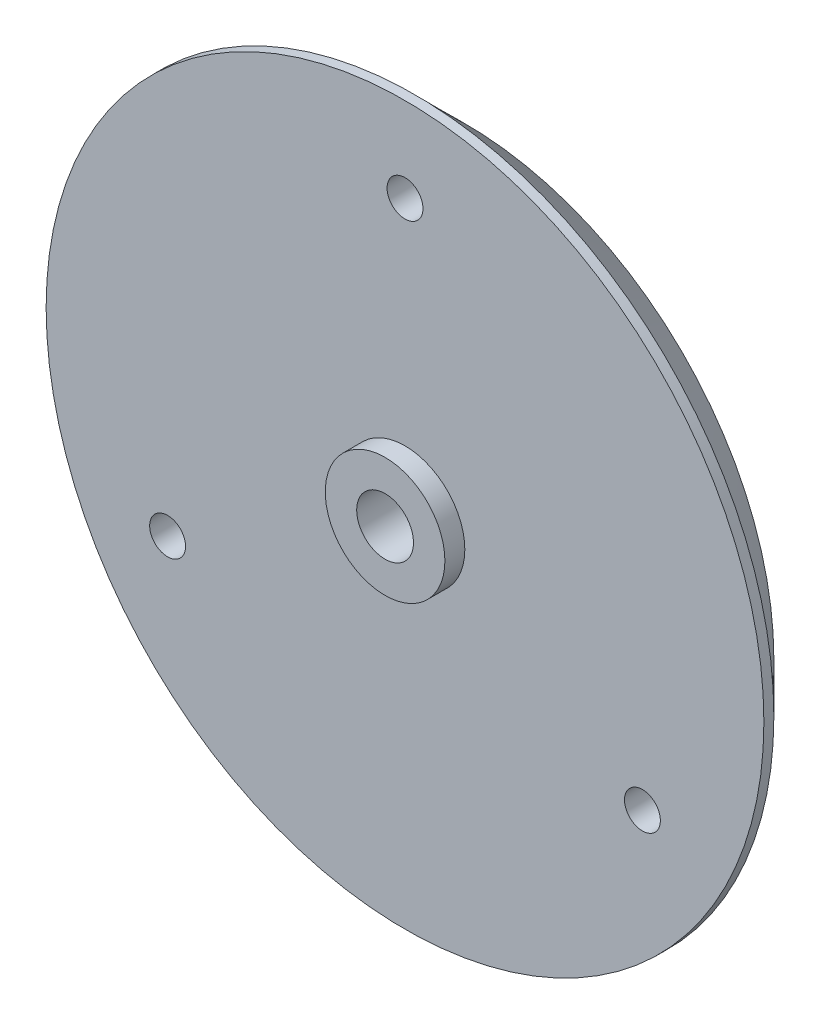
SolidWorks part; units mm, degrees
ref_plane "Plan de face" through (0, 0, 0) normal (0, 0, 1) x (1, 0, 0)
ref_plane "Plan de dessus" through (0, 0, 0) normal (0, 1, 0) x (1, 0, 0)
ref_plane "Plan de droite" through (0, 0, 0) normal (1, 0, 0) x (0, 0, -1)
sketch "Esquisse1" plane through (0, 0, 0) normal (0, 0, 1) x (1, 0, 0)
  circle A1 centre (0, 0) radius 18
extrude "Extrusion1" add sketch "Esquisse1" along normal blind 3
chamfer "Chanfrein1" distance 2.5 angle 45 1 edges at (18, 0, 0)
sketch "Esquisse2" plane through (0, 0, 0) normal (0, 0, -1) x (-1, 0, 0)
  circle A0 centre (0, 0) radius 4.45 construction
  circle A1 centre (0, 0) radius 6.45 construction
  circle A2 centre (0, 0) radius 8.45 construction
  circle A3 centre (0, 0) radius 11.45 construction
  circle A4 centre (0, 0) radius 4.95
  circle A5 centre (0, 0) radius 3.95
  circle A6 centre (0, 0) radius 6.95
  circle A7 centre (0, 0) radius 8.95
  circle A8 centre (0, 0) radius 11.95
  circle A9 centre (0, 0) radius 5.95
  circle A10 centre (0, 0) radius 7.95
  circle A11 centre (0, 0) radius 10.95
  dimension "D1" = 0.5
  dimension "D2" = 0.5
  dimension "D3" = 0.5
  dimension "D4" = 0.5
extrude "Enlèv. mat.-Extru.1" cut sketch "Esquisse2" against normal blind 1.6
sketch "Esquisse3" plane through (0, 0, 0) normal (0, 0, -1) x (-1, 0, 0)
  circle A0 centre (0, 0) radius 13.75 construction
  circle A1 centre (0, 13.75) radius 0.9
extrude "Enlèv. mat.-Extru.2" cut sketch "Esquisse3" against normal through all
pattern_circular "Répétition circulaire1" count 3 every 120 about axis through (0, 0, 0) along (0, 0, 1) of "Enlèv. mat.-Extru.2"
sketch "Esquisse4" plane through (0, 0, 3) normal (0, 0, 1) x (1, 0, 0)
  circle A0 centre (0, 0) radius 3
extrude "Extrusion2" add sketch "Esquisse4" along normal blind 1
sketch "Esquisse5" plane through (0, 0, 0) normal (0, 0, -1) x (-1, 0, 0)
  circle A0 centre (0, 0) radius 1.425
extrude "Enlèv. mat.-Extru.3" cut sketch "Esquisse5" against normal through all
